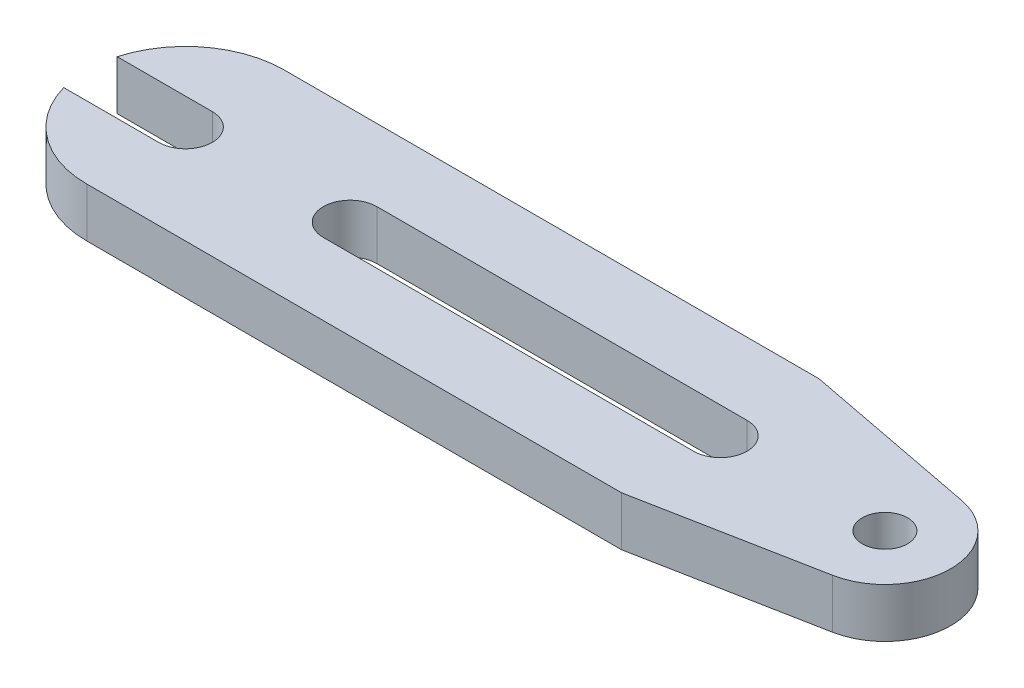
SolidWorks part; units mm, degrees
ref_plane "Front Plane" through (0, 0, 0) normal (0, 0, 1) x (1, 0, 0)
ref_plane "Top Plane" through (0, 0, 0) normal (0, 1, 0) x (1, 0, 0)
ref_plane "Right Plane" through (0, 0, 0) normal (1, 0, 0) x (0, 0, -1)
sketch "Sketch1" plane through (0, 0, 0) normal (0, 1, 0) x (1, 0, 0)
  line L0 (0, 0) -> (121.805, 0) construction
  line L1 (20, -3.25) -> (65, -3.25)
  line L2 (65, 3.25) -> (20, 3.25)
  line L3 (0, 3.25) -> (-11.5515, 3.25)
  line L4 (0, -3.25) -> (-11.5515, -3.25)
  line L5 (0, 12) -> (65, 12)
  line L6 (0, -12) -> (65, -12)
  line L7 (65, 0) -> (65, -12) construction
  line L8 (65, 0) -> (65, 12) construction
  line L9 (65, 12) -> (86.5133, 7.8556)
  line L10 (65, -12) -> (86.5133, -7.8556)
  arc A0 (0, -3.25) -> (0, 3.25) centre (0, 0) ccw
  arc A1 (20, 3.25) -> (20, -3.25) centre (20, 0) ccw
  arc A2 (65, -3.25) -> (65, 3.25) centre (65, 0) ccw
  circle A3 centre (85, 0) radius 2.75
  arc A4 (-11.5515, -3.25) -> (0, -12) centre (0, 0) ccw
  arc A5 (86.5133, -7.8556) -> (86.5133, 7.8556) centre (85, 0) ccw
  arc A6 (0, 12) -> (-11.5515, 3.25) centre (0, 0) ccw
  dimension "D1" = 6.5
  dimension "D2" = 5.5
  dimension "D3" = 20
  dimension "D4" = 20
  dimension "D5" = 45
  dimension "D6" = 24
  dimension "D7" = 16
extrude "Extrude1" add sketch "Sketch1" along normal blind 6
